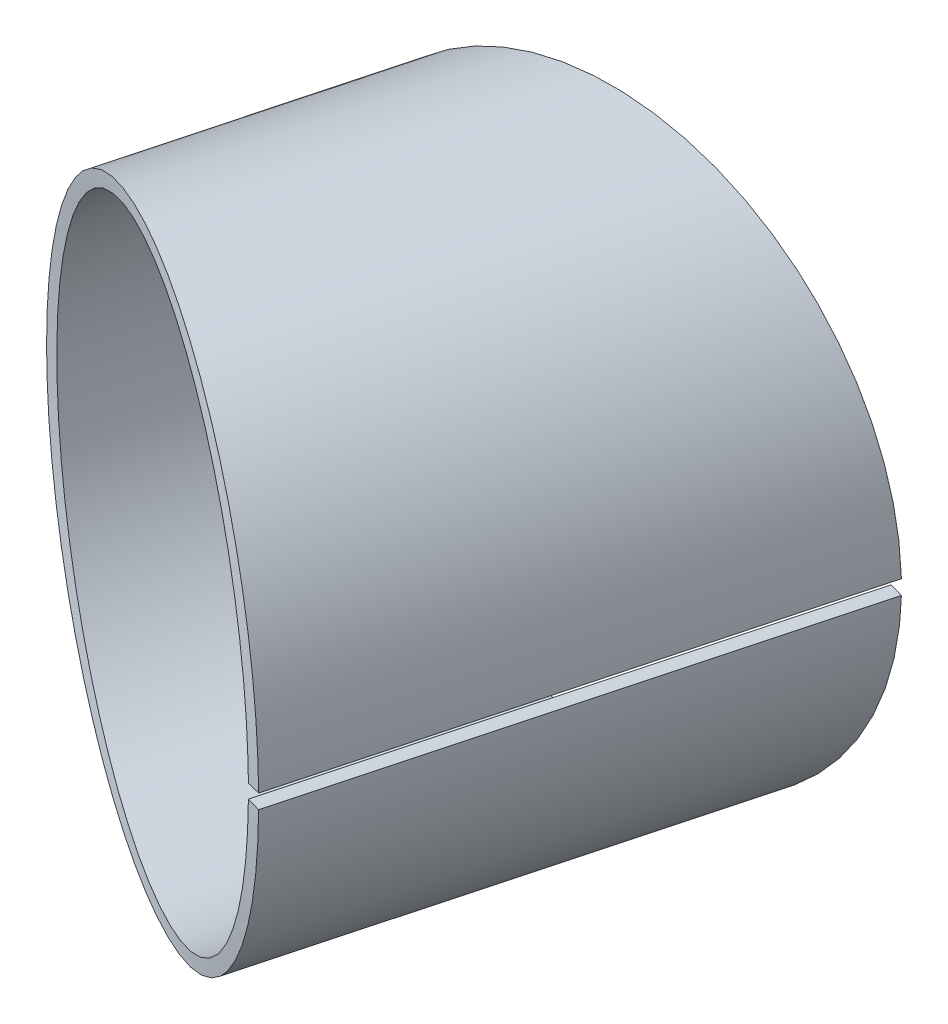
SolidWorks part; units mm, degrees
ref_plane "Płaszczyzna przednia" through (0, 0, 0) normal (0, 0, 1) x (1, 0, 0)
ref_plane "Płaszczyzna górna" through (0, 0, 0) normal (0, 1, 0) x (1, 0, 0)
ref_plane "Płaszczyzna prawa" through (0, 0, 0) normal (1, 0, 0) x (0, 0, -1)
sketch "Szkic1" plane through (0, 0, 0) normal (0, 0, 1) x (1, 0, 0)
  arc A0 (60.0125, -1) -> (60.0125, 1) centre (100, 0) ccw construction
  arc A1 (60.0125, -1) -> (60.0125, 1) centre (100, 0) ccw construction
  arc A2 (139.9875, 1) -> (139.9875, -1) centre (100, 0) ccw
sketch "Szkic2" plane through (0, 0, 0) normal (-0.5, 0, 0.866) x (0, -1, 0)
  arc A0 (1, 60.0125) -> (-1, 60.0125) centre (0, 100) ccw construction
  arc A1 (1, 60.0125) -> (-1, 60.0125) centre (0, 100) ccw construction
  arc A2 (-1, 139.9875) -> (1, 139.9875) centre (0, 100) ccw
lofted bend "Zgięcia wyciągnięte po profilach1" thickness 2 parameters "D1"=0
other "Zgięcie swobodnego formowania2" parameters "D1"=1000, "D4"=57.296, "D5"=1
sketch "Linie zgięcia1" [suppressed] plane through (0, 0, 0) normal (0, 1, 0) x (1, 0, 0)
sketch "Ramka-graniczna1" [suppressed] plane through (0, 0, 0) normal (0, 1, 0) x (1, 0, 0)
sheet metal parameters "Arkusz blachy1" thickness 2 parameters "D1"=4
flat pattern "Rozłożony model1"
sketch "Linie zgięcia2" plane through (0, 0, 0) normal (0, 1, 0) x (1, 0, 0)
sketch3d "Ramka-graniczna2" [suppressed]
  line L0 (37.776, 238.5824, 0) -> (36.2307, -0.2344, 0) construction
  line L1 (-34.6854, 239.0513, 0) -> (-36.2307, 0.2344, 0) construction
  line L2 (37.776, 238.5824, 0) -> (-34.6854, 239.0513, 0) construction
  line L3 (36.2307, -0.2344, 0) -> (-36.2307, 0.2344, 0) construction
other "Rozłożone-<Zgięcie swobodnego formowania2>1"
